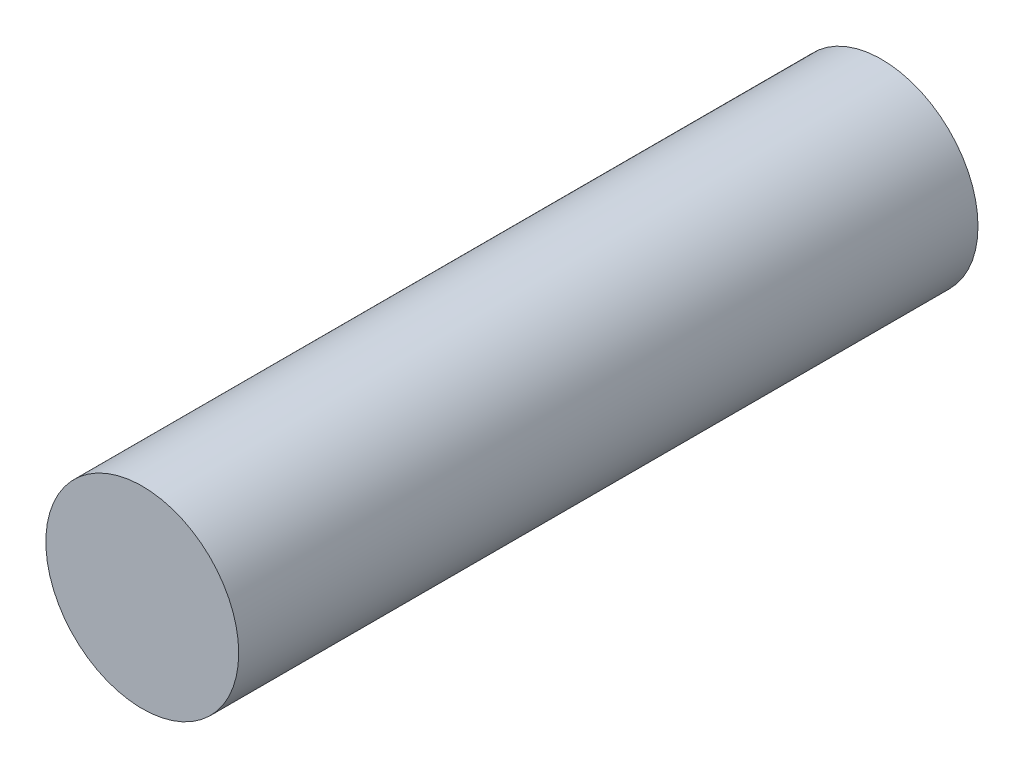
SolidWorks part; units mm, degrees
ref_plane "Front Plane" through (0, 0, 0) normal (0, 0, 1) x (1, 0, 0)
ref_plane "Top Plane" through (0, 0, 0) normal (0, 1, 0) x (1, 0, 0)
ref_plane "Right Plane" through (0, 0, 0) normal (1, 0, 0) x (0, 0, -1)
sketch "Sketch1" plane through (0, 0, 0) normal (0, 0, 1) x (1, 0, 0)
  circle A0 centre (0, 0) radius 15
  dimension "D1" = 30
extrude "Boss-Extrude1" add sketch "Sketch1" along normal blind 115 contours A0
hole_wizard "Ø25.0mm Dowel Hole9" positions "Sketch21" profile "Sketch23" hole size "Ø25.0" standard "ANSI Metric"
sketch "Sketch21" plane through (0, 0, 0) normal (0, 0, -1) x (-1, 0, 0)
  point P0 (0, 0)
sketch "Sketch23" plane through (0, 0, 0) normal (1, 0, 0) x (0, 1, 0)
  line L0 (0, 0) -> (0, 114.5125)
  line L1 (0, 114.5125) -> (14.5, 105.8)
  line L2 (14.5, 105.8) -> (14.5, 0)
  line L5 (14.5, 0) -> (0, 0)
  line L10 (0, 114.5125) -> (-14.5, 105.8) construction
  line L11 (0, -6.35) -> (0, 107.95) construction
  dimension "Hole Dia." = 29
  dimension "Hole Depth" = 105.8
  dimension "Drill Angle" = 118
